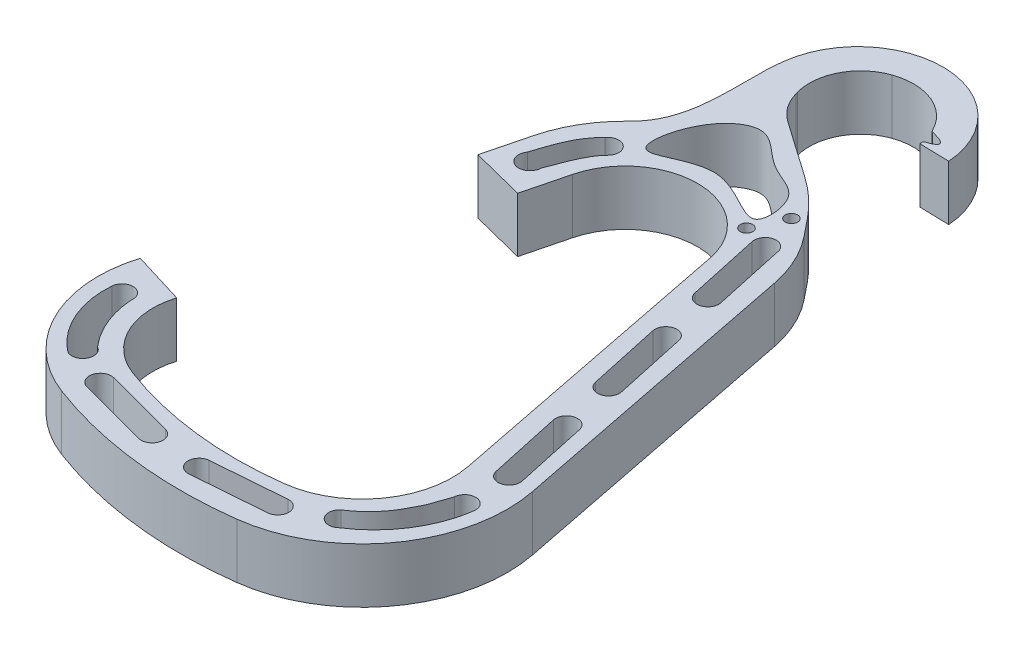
SolidWorks part; units mm, degrees
ref_plane "Front Plane" through (0, 0, 0) normal (0, 0, 1) x (1, 0, 0)
ref_plane "Top Plane" through (0, 0, 0) normal (0, 1, 0) x (1, 0, 0)
ref_plane "Right Plane" through (0, 0, 0) normal (1, 0, 0) x (0, 0, -1)
sketch "Sketch1" plane through (0, 0, 0) normal (0, 1, 0) x (1, 0, 0)
  line L0 (20.164, 43.6693) -> (30.4997, -8.6598)
  line L1 (-4.3226, 44.3201) -> (-6.2531, 36.7012)
  line L2 (-6.2531, 36.7012) -> (-20.1127, -8.5853) construction
  line L3 (-13.5559, 46.6596) -> (-15.4863, 39.0406)
  line L4 (29.5085, 45.5149) -> (39.8442, -6.8141)
  line L5 (-15.4863, 39.0406) -> (-6.2531, 36.7012)
  line L6 (-29.2207, -5.7979) -> (-20.1127, -8.5853)
  line L7 (-2.9638, 79.67) -> (26.3238, 78.8916) construction
  line L8 (-4.3226, 44.3201) -> (20.164, 43.6693) construction
  line L9 (-7.4009, 57.2052) -> (-2.9638, 79.67) construction
  line L10 (-2.4172, 56.2208) -> (2.0582, 78.8795) construction
  line L11 (2.0582, 78.8795) -> (3.807, 72.7162)
  line L12 (3.807, 72.7162) -> (19.9176, 61.452)
  line L13 (19.9176, 61.452) -> (25.0452, 55.0838)
  line L14 (26.3238, 78.8916) -> (21.2079, 79.0276)
  arc A0 (30.4997, -8.6598) -> (17.1892, -27.1534) centre (15.1965, -11.6824) cw
  arc A1 (20.164, 43.6693) -> (-4.3226, 44.3201) centre (7.8474, 41.2366) ccw
  arc A2 (17.1892, -27.1534) -> (-12.7287, -23.6408) centre (9.2557, 34.4411) cw
  arc A3 (-12.7287, -23.6408) -> (-20.1127, -8.5853) centre (-8.3883, -12.1735) cw
  arc A4 (29.5085, 45.5149) -> (-13.5559, 46.6596) centre (7.8474, 41.2366) ccw
  arc A5 (39.8442, -6.8141) -> (18.406, -36.6004) centre (15.1965, -11.6824) cw
  arc A6 (18.406, -36.6004) -> (-16.1005, -32.549) centre (9.2557, 34.4411) cw
  arc A7 (-16.1005, -32.549) -> (-29.2207, -5.7979) centre (-8.3883, -12.1735) cw
  arc A8 (-2.9638, 79.67) -> (26.3238, 78.8916) centre (11.6417, 77.8397) cw
  arc A9 (2.0582, 78.8795) -> (21.2567, 78.5286) centre (11.6417, 77.8397) cw
  spline S1 degree 3 poles (-7.4009, 57.2052) (-1.4951, 62.8446) (-3.9809, 73.1576) (-2.9638, 79.67) knots 0 0 0 0 1 1 1 1
  dimension "D1" = 53.34
  dimension "D2" = 7.8597
  dimension "D4" = 5.08
  dimension "D3" = 9.525
extrude "Boss-Extrude3" add sketch "Sketch1" along normal blind 9.525
fillet "Fillet2" radius 8.89 2 edges at (2.0582, 4.7625, -78.8795) (3.807, 4.7625, -72.7162)
fillet "Fillet3" radius 31.75 1 edges at (19.9176, 4.7625, -61.452)
sketch "Sketch2" plane through (0, 9.525, 0) normal (0, 1, 0) x (1, 0, 0)
  arc A0 (21.2079, 79.0276) -> (8.4502, 86.9358) centre (11.6417, 77.8397) ccw construction
  spline S0 degree 2 poles (20.3611, 81.9502) (25.0797, 80.8078) (21.1112, 79.6431) knots 0 0 0 1 1 1
  point P2 (20.8764, 80.6044)
  dimension "D1" = 2.032
extrude "Cut-Extrude1" cut sketch "Sketch2" against normal through all contours S0 M9
fillet "Fillet4" radius 0.254 2 edges at (20.3611, 4.7625, -81.9502) (21.1112, 4.7625, -79.6431)
sketch "Sketch5" plane through (0, 9.525, 0) normal (0, 1, 0) x (1, 0, 0)
  line L0 (23.2067, 50.1747) -> (25.9618, 37.4747) construction
  line L1 (22.6569, 52.7094) -> (40.5777, -29.9011) construction
  line L2 (25.0684, 50.5786) -> (27.8235, 37.8786)
  line L3 (21.345, 49.7708) -> (24.1001, 37.0708)
  line L4 (27.9811, 28.1662) -> (30.7361, 15.4662) construction
  line L5 (29.8428, 28.5701) -> (32.5978, 15.8701)
  line L6 (26.1194, 27.7623) -> (28.8744, 15.0623)
  line L7 (32.7554, 6.1577) -> (35.5104, -6.5423) construction
  line L8 (34.6171, 6.5616) -> (37.3721, -6.1384)
  line L9 (30.8937, 5.7538) -> (33.6487, -6.9462)
  line L16 (19.9201, -31.0874) -> (7.2587, -32.0775) construction
  line L17 (20.0686, -32.9866) -> (7.4073, -33.9767)
  line L18 (19.7716, -29.1882) -> (7.1102, -30.1783)
  line L19 (-1.799, -31.1554) -> (-14.0698, -27.8818) construction
  line L20 (-2.29, -32.996) -> (-14.5609, -29.7224)
  line L21 (-1.3079, -29.3148) -> (-13.5788, -26.0412)
  arc A0 (25.0684, 50.5786) -> (21.345, 49.7708) centre (23.2067, 50.1747) ccw
  arc A1 (24.1001, 37.0708) -> (27.8235, 37.8786) centre (25.9618, 37.4747) ccw
  arc A2 (29.8428, 28.5701) -> (26.1194, 27.7623) centre (27.9811, 28.1662) ccw
  arc A3 (28.8744, 15.0623) -> (32.5978, 15.8701) centre (30.7361, 15.4662) ccw
  arc A4 (34.6171, 6.5616) -> (30.8937, 5.7538) centre (32.7554, 6.1577) ccw
  arc A5 (33.6487, -6.9462) -> (37.3721, -6.1384) centre (35.5104, -6.5423) ccw
  arc A6 (-11.6001, 43.7116) -> (-7.9734, 42.544) centre (-9.9685, 42.5633) ccw
  arc A7 (-3.9278, 50.4561) -> (-7.0373, 52.6577) centre (-5.4825, 51.5569) ccw
  arc A8 (37.6704, -14.6198) -> (33.8666, -14.4014) centre (35.7685, -14.5106) ccw
  arc A9 (25.9729, -26.1958) -> (28.5383, -29.0127) centre (27.2171, -27.6393) ccw
  arc A10 (20.0686, -32.9866) -> (19.7716, -29.1882) centre (19.9201, -31.0874) ccw
  arc A11 (7.1102, -30.1783) -> (7.4073, -33.9767) centre (7.2587, -32.0775) ccw
  arc A12 (-2.29, -32.996) -> (-1.3079, -29.3148) centre (-1.799, -31.1554) ccw
  arc A13 (-13.5788, -26.0412) -> (-14.5609, -29.7224) centre (-14.0698, -27.8818) ccw
  arc A14 (-21.3526, -26.1958) -> (-19.6326, -22.7961) centre (-20.4926, -24.4959) ccw
  arc A15 (-23.7077, -12.7065) -> (-27.5059, -12.4066) centre (-25.6068, -12.5566) ccw
  spline S0 degree 3 poles (-1.5162, 63.949) (-4.1301, 50.1305) (8.2961, 61.0856) (19.7375, 49.1971) (18.6708, 61.1709) (11.4715, 62.1507) (6.2769, 69.1473) (-1.5162, 63.949) (-4.1301, 50.1305) (8.2961, 61.0856) knots -0.413056 -0.281036 -0.160815 0 0.175122 0.368271 0.466834 0.586944 0.718964 0.839185 1 1.175122 1.368271 1.466834 only from (-1.799, 54.49) to (-1.799, 54.49)
  spline S1 degree 3 poles (37.6704, -14.6198) (36.9796, -20.4203) (33.4548, -25.8836) (28.5383, -29.0127) knots 0 0 0 0 1 1 1 1
  spline S2 degree 3 poles (25.9729, -26.1958) (30.2603, -23.4515) (32.0979, -18.4831) (32.6071, -18.2964) (33.8666, -14.4014) knots 0 0 0 0 0.681084 1 1 1 1
  spline S3 degree 3 poles (-23.7077, -12.7065) (-23.549, -16.4031) (-22.0362, -19.9898) (-19.6326, -22.7961) knots 0 0 0 0 1 1 1 1
  spline S4 degree 3 poles (-27.5059, -12.4066) (-27.949, -17.6843) (-25.5561, -23.0326) (-21.3526, -26.1958) knots 0 0 0 0 1 1 1 1
  spline S5 degree 3 poles (-11.6001, 43.7116) (-10.5747, 46.9201) (-9.5662, 50.2874) (-7.0373, 52.6577) knots 0 0 0 0 1 1 1 1
  spline S6 degree 3 poles (-7.9734, 42.544) (-6.844, 45.2939) (-6.1088, 48.2707) (-3.9278, 50.4561) knots 0 0 0 0 1 1 1 1
  point P4 (24.5843, 43.8247)
  point P9 (29.3586, 21.8162)
  point P16 (34.1329, -0.1923)
  point P23 (-8.2626, 46.5292)
  point P32 (34.1329, -23.6256)
  point P43 (13.5894, -31.5824)
  point P50 (-7.9344, -29.5186)
  point P57 (-22.1518, -18.9044)
  dimension "D17" = 9.525
  dimension "D19" = 9.525
  dimension "D20" = 12.9886
  dimension "D21" = 15.6682
  dimension "D7" = 3.81
  dimension "D8" = 12.7
  dimension "D10" = 3.81
  dimension "D11" = 3.81
  dimension "D2" = 12.7
  dimension "D3" = 12.7
  dimension "D4" = 12.7
  dimension "D5" = 3.81
  dimension "D6" = 12.7
  dimension "D9" = 3.81
  dimension "D12" = 3.81
  dimension "D13" = 3.81
  dimension "D14" = 3.81
  dimension "D15" = 3.81
  dimension "D16" = 3.81
  dimension "D18" = 3.81
extrude "Cut-Extrude6" cut sketch "Sketch5" against normal through all
sketch "Sketch6" plane through (0, 9.525, 0) normal (0, 1, 0) x (1, 0, 0)
  circle A0 centre (21.2894, 56.6477) radius 1.0795
  circle A1 centre (18.8207, 51.312) radius 1.0795
  dimension "D1" = 2.159
extrude "Cut-Extrude8" cut sketch "Sketch6" against normal through all
